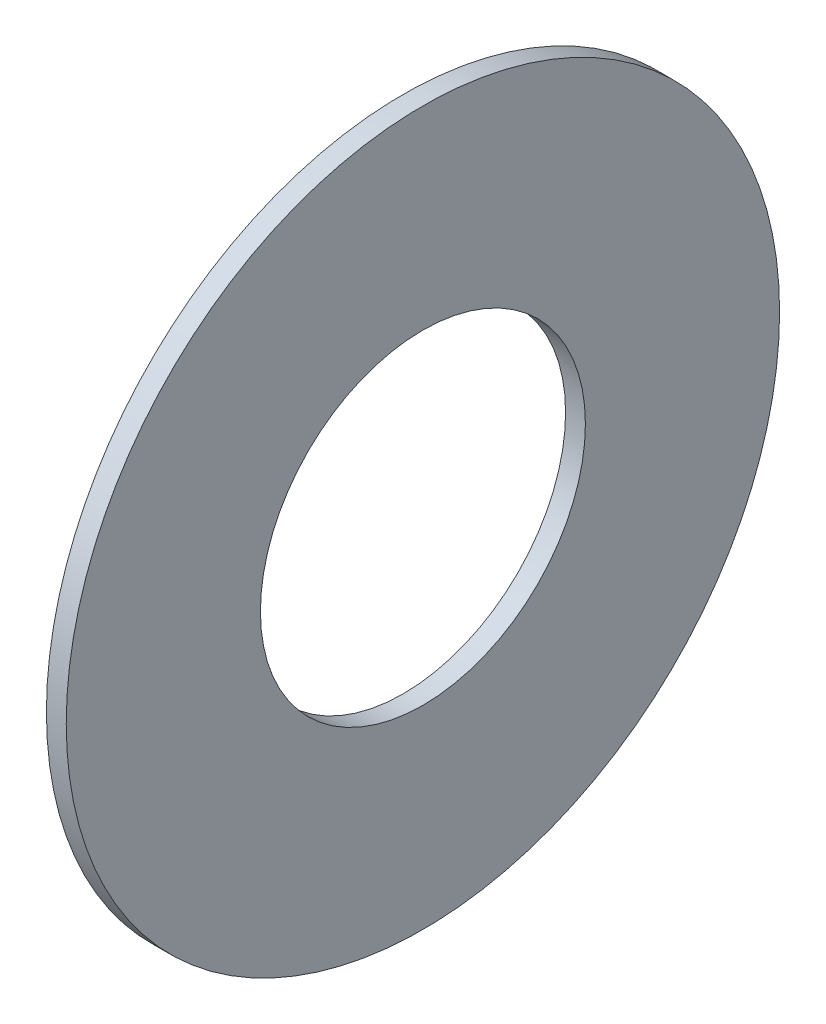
SolidWorks part; units mm, degrees
ref_plane "Plan de face" through (0, 0, 0) normal (0, 0, 1) x (1, 0, 0)
ref_plane "Plan de dessus" through (0, 0, 0) normal (0, 1, 0) x (1, 0, 0)
ref_plane "Plan de droite" through (0, 0, 0) normal (1, 0, 0) x (0, 0, -1)
sketch "Esquisse1" plane through (0, 0, 0) normal (0, 0, 1) x (1, 0, 0)
  line L0 (0.5, 4.1) -> (0.5, 9)
  line L1 (0.5, 9) -> (0, 9)
  line L2 (0, 9) -> (0, 4.1)
  line L3 (0, 4.1) -> (0.5, 4.1)
  line L4 (0, 0) -> (0.5, 0) construction
  dimension "D1" = 0.5
revolve "Révolution1" add sketch "Esquisse1" angle 360 about L4
